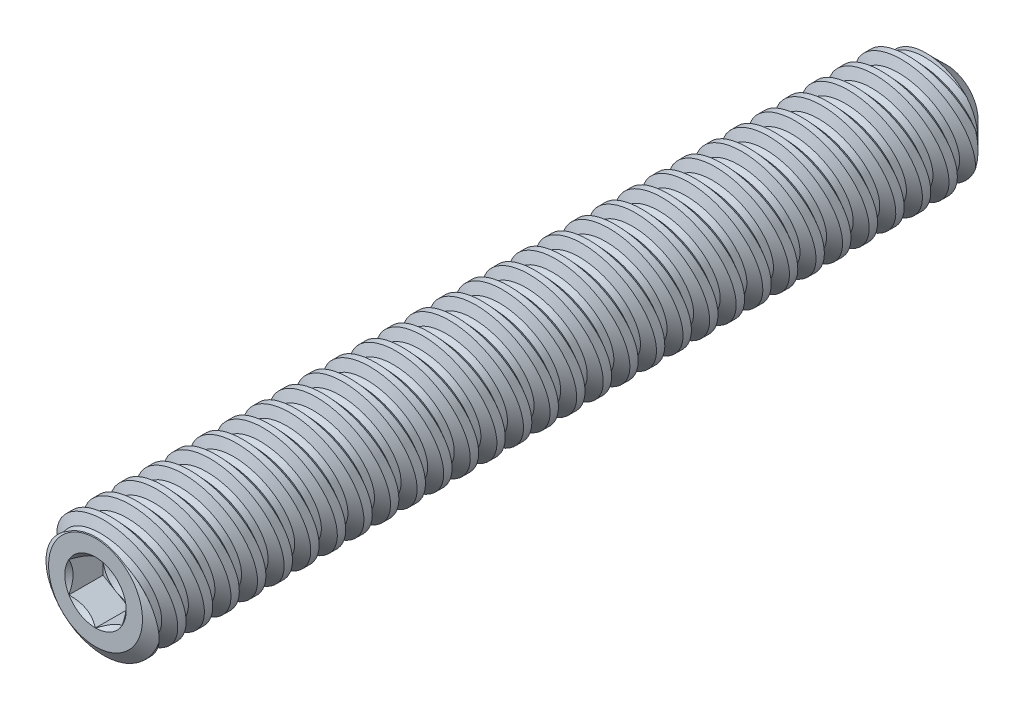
SolidWorks part; units mm, degrees
ref_plane "Front" through (0, 0, 0) normal (0, 0, 1) x (1, 0, 0)
ref_plane "Top" through (0, 0, 0) normal (0, 1, 0) x (1, 0, 0)
ref_plane "Right" through (0, 0, 0) normal (1, 0, 0) x (0, 0, -1)
sketch "Sketch22" plane through (0, 0, 0) normal (1, 0, 0) x (0, 0, -1)
  line L0 (-12.4177, 0) -> (-12.4177, 1.4021)
  line L1 (-12.4177, 1.4021) -> (-12.1722, 1.7526)
  line L2 (-12.1722, 1.7526) -> (12.1695, 1.7526)
  line L3 (12.1695, 1.7526) -> (12.9823, 0.9398)
  line L4 (12.9823, 0.9398) -> (12.4177, 0)
  line L5 (12.4177, 0) -> (-12.4177, 0)
  line L6 (12.4177, 0) -> (12.9823, 0) construction
  line L7 (12.9823, 0) -> (12.9823, 0.9398) construction
  line L8 (12.9823, -0.9398) -> (12.4177, 0) construction
  line L9 (-12.1722, -1.7526) -> (12.1695, -1.7526) construction
  dimension "Screw Dia" = 3.5052
  dimension "Length" = 25.4
  dimension "D3" = 35
  dimension "Cup Point Dia" = 1.8796
  dimension "D5" = 118
  dimension "D6" = 45
  dimension "D7" = 2.8042
revolve "Revolve1" add sketch "Sketch22" angle 360 about L6
sketch "Sketch6" plane through (0, 0, 0) normal (1, 0, 0) x (0, 0, -1)
  line L0 (10.918, 1.7526) -> (11.7118, -1.7526) construction
  line L1 (-12.1722, 1.7526) -> (12.1695, 1.7526) construction
  line L2 (-12.1722, -1.7526) -> (12.1695, -1.7526) construction
  line L3 (10.918, 1.7526) -> (11.0148, 1.7745) construction
  line L4 (11.5451, 1.4541) -> (11.3516, 1.4103)
  line L5 (11.3516, 1.4103) -> (11.0148, 1.7745)
  line L6 (11.5451, 1.4541) -> (11.6922, 1.9279)
  line L7 (11.6922, 1.9279) -> (11.0148, 1.7745)
  line L8 (11.3758, 1.7526) -> (12.1695, -1.7526) construction
  line L9 (12.6273, 0.1935) -> (10.918, -0.1935) construction
  line L10 (11.3535, 1.8512) -> (11.4484, 1.4322) construction
  line L13 (10.918, -1.7526) -> (10.918, 1.7526) construction
  line L14 (10.918, -1.7526) -> (11.7118, -1.7526) construction
  line L15 (11.7118, -1.7526) -> (12.1695, -1.7526) construction
  line L18 (10.918, 1.7526) -> (11.3758, 1.7526) construction
  point P18 (11.7727, 0)
  dimension "D1" = 0.7937
  dimension "D2" = 0.1984
  dimension "D3" = 60
  dimension "D4" = 0.0992
  dimension "Pitch" = 0.7937
revolve "Cut-Revolve8" cut sketch "Sketch6" angle 360 about L9
pattern_linear "LPattern1" count 31 spacing 0.7937 along (0, 0, 1) count 2 spacing 0.7937 along (0, 0, -1) of "Cut-Revolve8"
sketch "Sketch23" plane through (0, 0, 12.4177) normal (0, 0, 1) x (1, 0, 0)
  line L1 (0, 0.9165) -> (-0.7938, 0.4583)
  line L2 (-0.7938, 0.4583) -> (-0.7938, -0.4583)
  line L3 (-0.7938, -0.4583) -> (0, -0.9165)
  line L4 (0, -0.9165) -> (0.7937, -0.4583)
  line L5 (0.7937, -0.4583) -> (0.7937, 0.4583)
  line L6 (0.7937, 0.4583) -> (0, 0.9165)
  circle A0 centre (0, 0) radius 0.7938 construction
  dimension "Hex" = 1.5875
extrude "Cut-Extrude10" cut sketch "Sketch23" against normal blind 1.016
sketch "Sketch24" plane through (0, 0, 12.4177) normal (0, 0, 1) x (1, 0, 0)
  circle A0 centre (0, 0) radius 0.9165
extrude "Cut-Extrude11" cut sketch "Sketch24" against normal through all draft 45
sketch "Sketch26" plane through (0, 0, 11.4017) normal (0, 0, 1) x (1, 0, 0)
  circle A0 centre (0, 0) radius 0.7938 construction
  circle A1 centre (0, 0) radius 0.7938
extrude "Cut-Extrude12" cut sketch "Sketch26" against normal through all draft 59
sketch "Sketch27" plane through (0, 0, 12.4177) normal (0, 0, 1) x (1, 0, 0)
  point P0 (0, 0)
equation "\"D2@Sketch6\"=\"Pitch@Sketch6\"/4"
equation "\"D4@Sketch6\"=\"Pitch@Sketch6\"/8"
equation "\"D1@Sketch6\"=\"Pitch@Sketch6\""
equation "\"D3@LPattern1\"=\"Pitch@Sketch6\""
equation "\"D1@LPattern1\"=(\"Length@Sketch22\"/\"Pitch@Sketch6\")-1"
equation "\"D4@LPattern1\"=\"Pitch@Sketch6\""
equation "\"D7@Sketch22\"=\"Screw Dia@Sketch22\"*.8"
